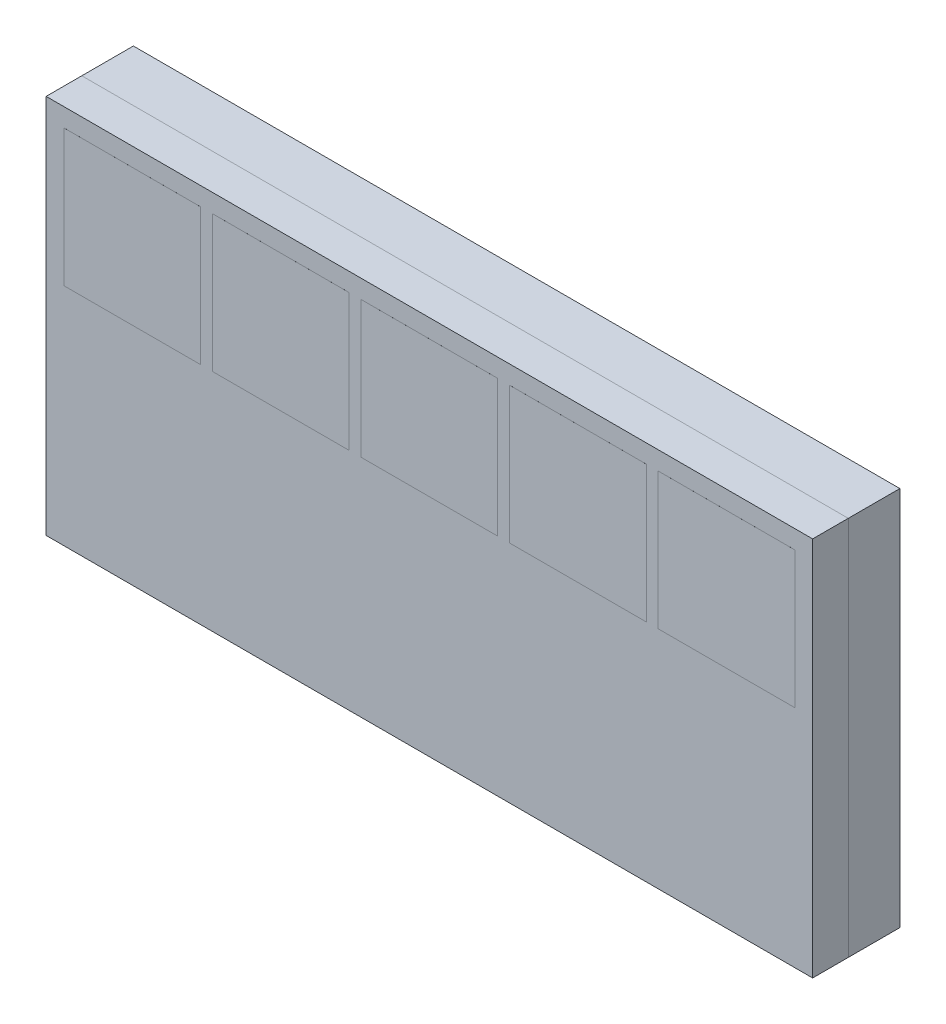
SolidWorks part; units mm, degrees
ref_plane "前视基准面" through (0, 0, 0) normal (0, 0, 1) x (1, 0, 0)
ref_plane "上视基准面" through (0, 0, 0) normal (0, 1, 0) x (1, 0, 0)
ref_plane "右视基准面" through (0, 0, 0) normal (1, 0, 0) x (0, 0, -1)
sketch "草图1" plane through (0, 0, 0) normal (0, 0, 1) x (1, 0, 0)
  line L1 (-3.225, 0.73) -> (3.225, 0.73)
  line L2 (-3.225, 0.73) -> (-3.225, -2.47)
  line L3 (-3.225, -2.47) -> (3.225, -2.47)
  line L4 (3.225, 0.73) -> (3.225, -2.47)
  line L5 (-3.225, 0.73) -> (3.225, -2.47) construction
  line L6 (-3.225, -2.47) -> (3.225, 0.73) construction
  point P0 (0, -0.87)
  point P5 (0, 1.3357)
  point P6 (0, 1.3357)
  point P7 (0, 0)
  point P8 (0, 0)
  dimension "D1" = 3.2
  dimension "D2" = 6.45
  dimension "D3" = 0
  dimension "D4" = 0.87
extrude "凸台-拉伸1" add sketch "草图1" against normal blind 0.3
sketch "草图2" plane through (0, 0, 0) normal (0, 0, 1) x (1, 0, 0)
  line L0 (3.225, 0.73) -> (-3.225, 0.73) construction
  line L1 (-3.075, 0.575) -> (-1.925, 0.575)
  line L2 (-3.075, 0.575) -> (-3.075, -0.575)
  line L3 (-3.075, -0.575) -> (-1.925, -0.575)
  line L4 (-1.925, 0.575) -> (-1.925, -0.575)
  line L5 (-3.075, 0.575) -> (-1.925, -0.575) construction
  line L6 (-3.075, -0.575) -> (-1.925, 0.575) construction
  line L7 (-3.225, 0.73) -> (-3.225, -2.47) construction
  line L8 (-1.825, 0.575) -> (-1.825, -0.575)
  line L9 (-1.825, 0.575) -> (-0.675, 0.575)
  line L10 (-0.675, 0.575) -> (-0.675, -0.575)
  line L11 (-1.825, -0.575) -> (-0.675, -0.575)
  line L12 (-0.575, 0.575) -> (-0.575, -0.575)
  line L13 (-0.575, 0.575) -> (0.575, 0.575)
  line L14 (0.575, 0.575) -> (0.575, -0.575)
  line L15 (-0.575, -0.575) -> (0.575, -0.575)
  line L16 (0.675, 0.575) -> (0.675, -0.575)
  line L17 (0.675, 0.575) -> (1.825, 0.575)
  line L18 (1.825, 0.575) -> (1.825, -0.575)
  line L19 (0.675, -0.575) -> (1.825, -0.575)
  line L20 (1.925, 0.575) -> (1.925, -0.575)
  line L21 (1.925, 0.575) -> (3.075, 0.575)
  line L22 (3.075, 0.575) -> (3.075, -0.575)
  line L23 (1.925, -0.575) -> (3.075, -0.575)
  point P0 (-2.5, 0)
  point P10 (2.5, 0)
  dimension "D1" = 1.15
  dimension "D2" = 1.15
  dimension "D3" = 0.155
  dimension "D4" = 0.15
  dimension "D5" = 5
extrude "凸台-拉伸2" add sketch "草图2" along normal blind 0.0001
sketch "草图4" plane through (0, 0, -0.3) normal (0, 0, -1) x (-1, 0, 0)
  line L4 (-3.225, 0.73) -> (-3.225, -2.47)
  line L5 (-3.225, -2.47) -> (3.225, -2.47)
  line L6 (3.225, -2.47) -> (3.225, 0.73)
  line L7 (3.225, 0.73) -> (-3.225, 0.73)
  line L8 (-3.225, 0.73) -> (-3.225, -2.47)
  line L9 (-3.225, -2.47) -> (3.225, -2.47)
  line L10 (3.225, -2.47) -> (3.225, 0.73)
  line L11 (3.225, 0.73) -> (-3.225, 0.73)
  dimension "D1" = 0
extrude "凸台-拉伸3" add sketch "草图4" along normal blind 0.434 separate body
sketch "草图5" plane through (0, 0, -0.734) normal (0, 0, -1) x (-1, 0, 0)
  line L0 (-3.225, 0.73) -> (-3.225, -2.47) construction
  line L1 (-2.45, 0.55) -> (-0.5, 0.55)
  line L2 (-2.75, 0.25) -> (-2.75, -0.37)
  line L3 (-2.45, -0.67) -> (-0.5, -0.67)
  line L4 (-0.2, 0.25) -> (-0.2, -0.37)
  line L5 (-2.75, 0.55) -> (-0.2, -0.67) construction
  line L6 (-2.75, -0.67) -> (-0.2, 0.55) construction
  line L7 (3.225, 0.73) -> (-3.225, 0.73) construction
  line L8 (0.2, 0.25) -> (0.2, -0.37)
  line L9 (0.5, 0.55) -> (2.45, 0.55)
  line L10 (2.75, 0.25) -> (2.75, -0.37)
  line L11 (0.5, -0.67) -> (2.45, -0.67)
  line L12 (0.2, -1.47) -> (0.2, -1.99)
  line L13 (0.6, -1.07) -> (2.45, -1.07)
  line L14 (2.75, -1.37) -> (2.75, -1.99)
  line L15 (0.5, -2.29) -> (2.45, -2.29)
  line L16 (-2.75, -1.37) -> (-2.75, -1.99)
  line L17 (-2.45, -1.07) -> (-0.5, -1.07)
  line L18 (-0.2, -1.37) -> (-0.2, -1.99)
  line L19 (-2.45, -2.29) -> (-0.5, -2.29)
  line L22 (-3.225, -2.47) -> (3.225, -2.47) construction
  line L23 (0.2, -1.47) -> (0.6, -1.07)
  arc A0 (-0.5, 0.55) -> (-0.2, 0.25) centre (-0.5, 0.25) cw
  arc A1 (-0.2, -0.37) -> (-0.5, -0.67) centre (-0.5, -0.37) cw
  arc A2 (-2.45, -0.67) -> (-2.75, -0.37) centre (-2.45, -0.37) cw
  arc A3 (-2.75, 0.25) -> (-2.45, 0.55) centre (-2.45, 0.25) cw
  arc A4 (0.2, 0.25) -> (0.5, 0.55) centre (0.5, 0.25) cw
  arc A5 (0.5, -0.67) -> (0.2, -0.37) centre (0.5, -0.37) cw
  arc A6 (2.45, 0.55) -> (2.75, 0.25) centre (2.45, 0.25) cw
  arc A7 (2.75, -0.37) -> (2.45, -0.67) centre (2.45, -0.37) cw
  arc A9 (0.5, -2.29) -> (0.2, -1.99) centre (0.5, -1.99) cw
  arc A10 (2.45, -1.07) -> (2.75, -1.37) centre (2.45, -1.37) cw
  arc A11 (2.75, -1.99) -> (2.45, -2.29) centre (2.45, -1.99) cw
  arc A12 (-2.75, -1.37) -> (-2.45, -1.07) centre (-2.45, -1.37) cw
  arc A13 (-2.45, -2.29) -> (-2.75, -1.99) centre (-2.45, -1.99) cw
  arc A14 (-0.5, -1.07) -> (-0.2, -1.37) centre (-0.5, -1.37) cw
  arc A15 (-0.2, -1.99) -> (-0.5, -2.29) centre (-0.5, -1.99) cw
  arc A16 (0.2, -1.37) -> (0.5, -1.07) centre (0.5, -1.37) cw
  point P0 (-1.475, -0.06)
  dimension "D5" = 0.3
  dimension "D1" = 2.55
  dimension "D2" = 1.22
  dimension "D3" = 0.475
  dimension "D4" = 0.18
  dimension "D10" = 0.18
  dimension "D6" = 2
  dimension "D7" = 2
extrude "凸台-拉伸4" add sketch "草图5" along normal blind 0.056
